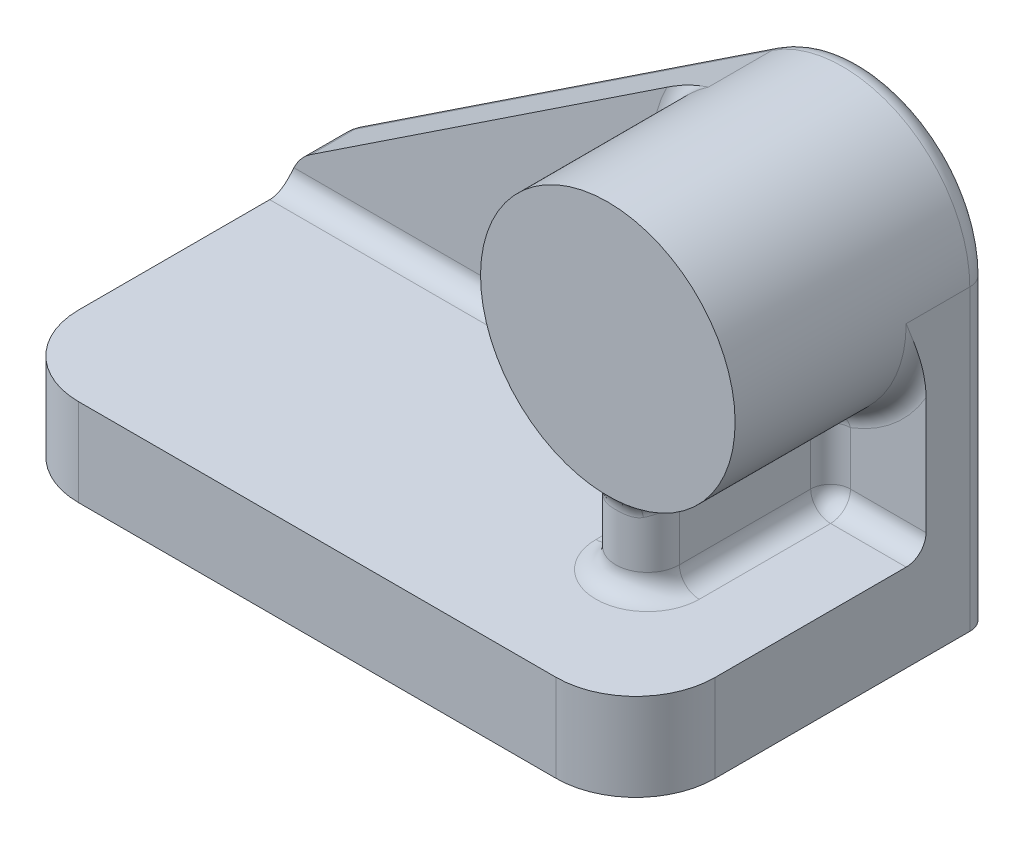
SolidWorks part; units mm, degrees
ref_plane "Front" through (0, 0, 0) normal (0, 0, 1) x (1, 0, 0)
ref_plane "Top" through (0, 0, 0) normal (0, 1, 0) x (1, 0, 0)
ref_plane "Right" through (0, 0, 0) normal (1, 0, 0) x (0, 0, -1)
sketch "Sketch1" plane through (0, 0, 0) normal (0, 1, 0) x (1, 0, 0)
  line L0 (0, 0) -> (160, 0)
  line L1 (0, 0) -> (0, 89)
  line L2 (160, 89) -> (0, 89)
  line L3 (160, 89) -> (160, 0)
  dimension "D3" = 89
  dimension "D4" = 160
extrude "Base_Plate" add sketch "Sketch1" along normal blind 22
fillet "Base_Fillet" radius 20 2 edges at (0, 11, 0) (160, 11, 0)
shell "Wall_Thickness" thickness 2
sketch "Sketch2" plane through (0, 0, -89) normal (0, 0, -1) x (-1, 0, 0)
  line L1 (-160, 0) -> (0, 0) construction
  line L2 (-160, 22) -> (0, 22) construction
  line L3 (-160, 22) -> (0, 22)
  line L4 (-160, 22) -> (-160, 0) construction
  line L5 (-160, 22) -> (-160, 75)
  line L6 (-5.3632, 31.9976) -> (-110.3018, 101.6603)
  arc A0 (-110.3018, 101.6603) -> (-160, 75) centre (-128, 75) ccw
  arc A1 (0, 22) -> (-5.3632, 31.9976) centre (-12, 22) ccw
  dimension "D1" = 64
  dimension "D4" = 12
  dimension "D2" = 75
extrude "Vertical_Plate" add sketch "Sketch2" against normal blind 16
sketch "Sketch3" plane through (0, 0, -89) normal (0, 0, -1) x (-1, 0, 0)
  circle A0 centre (-128, 75) radius 32
  arc A1 (-110.3018, 101.6603) -> (-160, 75) centre (-128, 75) ccw construction
extrude "Circular_Boss" add sketch "Sketch3" against normal blind 64
sketch "Sketch4" plane through (0, 22, 0) normal (0, 1, 0) x (-1, 0, 0)
  line L0 (-96, -25) -> (-160, -25) construction
  line L1 (-96, -73) -> (-160, -73) construction
  line L2 (-120, -73) -> (-120, -35)
  line L4 (-128, -73) -> (-128, -89) construction
  line L5 (-136, -73) -> (-136, -35)
  line L7 (-136, -73) -> (-120, -73)
  arc A0 (-120, -35) -> (-136, -35) centre (-128, -35) ccw
  dimension "D2" = 8
  dimension "D1" = 2
extrude "Rib_Under" add sketch "Sketch4" along normal up to next
fillet "Rib_Fillet" radius 5 7 edges at (120, 44.0161, -54) (120, 22, -54) (127.1921, 43.0102, -27.0409) (128, 22, -27) (136, 22, -54) (136, 44.0161, -54)
fillet "Circ_Fillet" radius 5 18 edges at (1.4255, 27.6726, -89) (57.8325, 66.829, -89) (143.1271, 103.1988, -89) (154.3038, 56.7762, -73) (160, 37.5, -89) (0, 11, -89) (136, 33.6795, -73) (136.89, 43.2065, -73) (137.4645, 23.4645, -73) (96.206, 71.3753, -73) (120, 33.6795, -73) (119.11, 43.2065, -73) (118.5355, 23.4645, -73)
